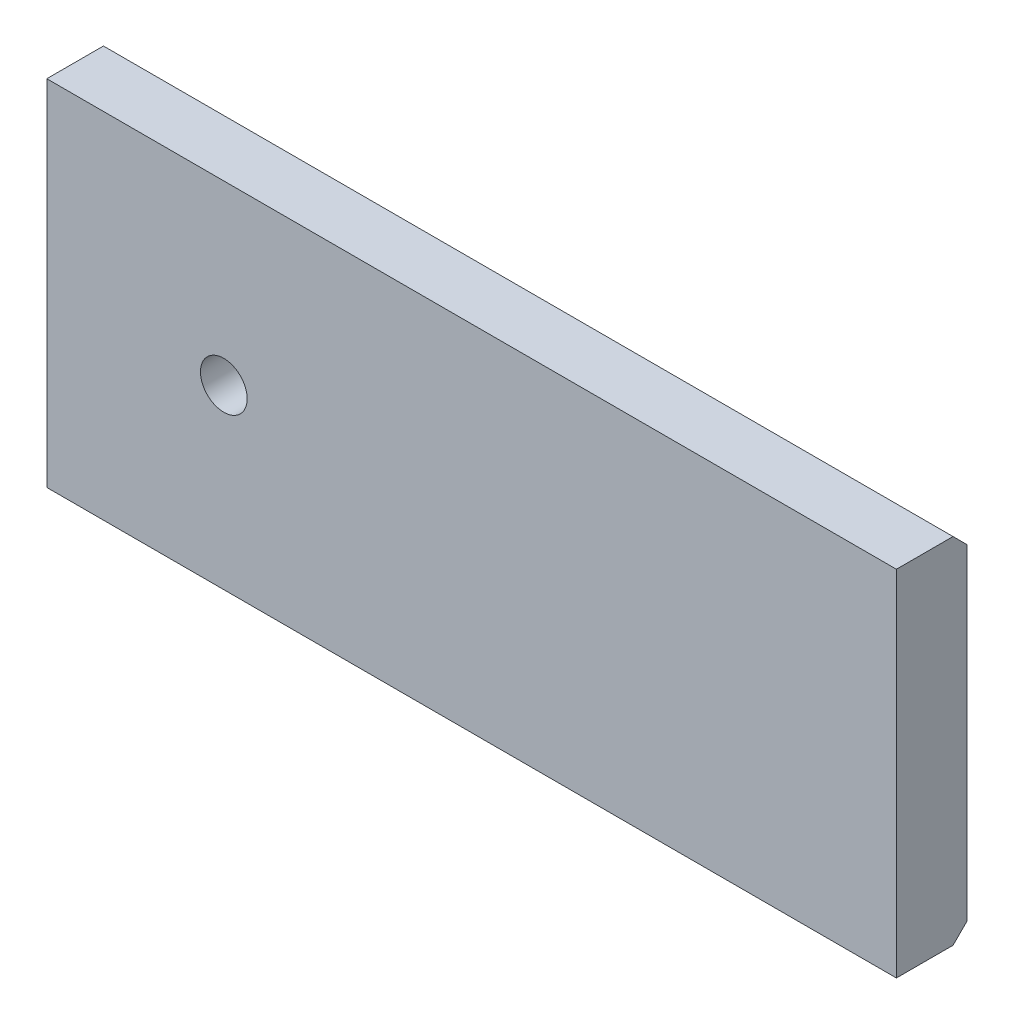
SolidWorks part; units mm, degrees
ref_plane "Plan de face" through (0, 0, 0) normal (0, 0, 1) x (1, 0, 0)
ref_plane "Plan de dessus" through (0, 0, 0) normal (0, 1, 0) x (1, 0, 0)
ref_plane "Plan de droite" through (0, 0, 0) normal (1, 0, 0) x (0, 0, -1)
sketch "Esquisse1" plane through (0, 0, 0) normal (0, 0, 1) x (1, 0, 0)
  line L0 (-39.245, 0) -> (109.1135, 0) construction
  line L2 (0, 25) -> (120, 25)
  line L3 (0, 25) -> (0, -25)
  line L4 (0, -25) -> (120, -25)
  line L5 (120, 25) -> (120, -25)
  dimension "D1" = 120
  dimension "D2" = 50
  dimension "D3" = 25
extrude "Boss.-Extru.1" add sketch "Esquisse1" along normal blind 10
sketch "Esquisse2" plane through (0, 0, 0) normal (0, 0, -1) x (-1, 0, 0)
  circle A0 centre (-25, 0) radius 3.2992
  dimension "D1" = 25
extrude "Enlèv. mat.-Extru.1" cut sketch "Esquisse2" against normal through all
chamfer "Chanfrein1" distance 2 angle 45 2 edges at (60, 25, 0) (60, -25, 0)
